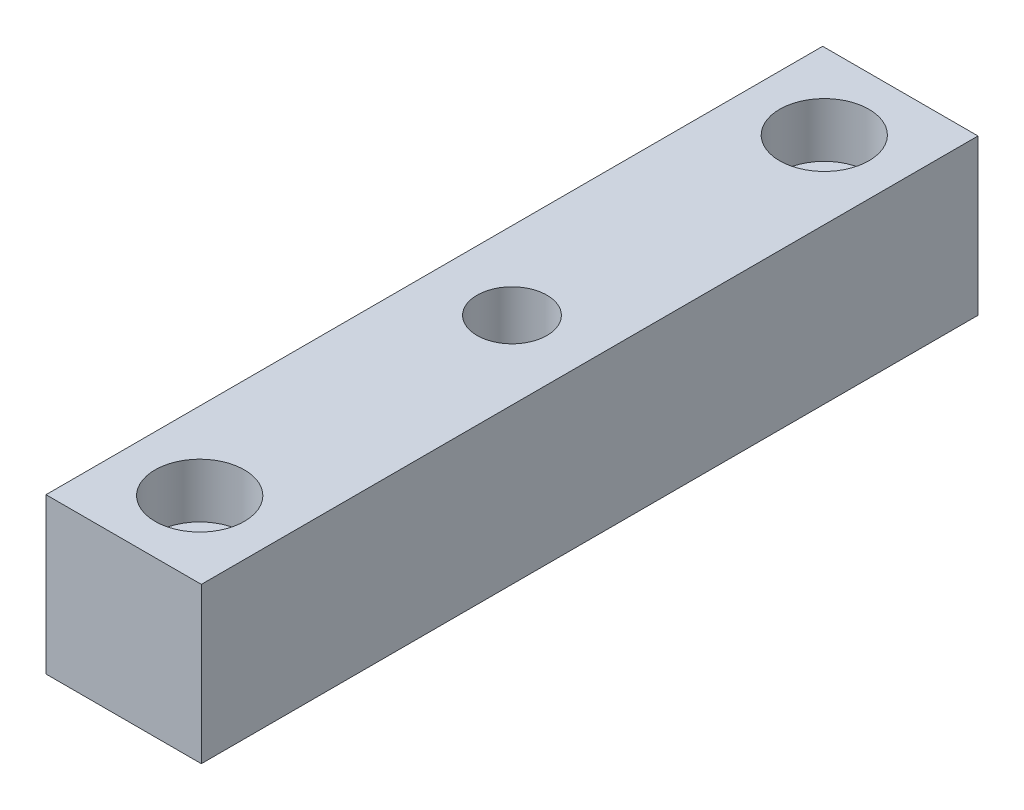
SolidWorks part; units mm, degrees
ref_plane "Plan de face" through (0, 0, 0) normal (0, 0, 1) x (1, 0, 0)
ref_plane "Plan de dessus" through (0, 0, 0) normal (0, 1, 0) x (1, 0, 0)
ref_plane "Plan de droite" through (0, 0, 0) normal (1, 0, 0) x (0, 0, -1)
sketch "Esquisse1" plane through (0, 0, 0) normal (0, 0, 1) x (1, 0, 0)
  line L1 (-20, 20) -> (20, 20)
  line L2 (-20, 20) -> (-20, -20)
  line L3 (-20, -20) -> (20, -20)
  line L4 (20, 20) -> (20, -20)
  dimension "D1" = 40
  dimension "D2" = 20
  dimension "D3" = 40
  dimension "D4" = 20
extrude "Extrusion1" add sketch "Esquisse1" along normal mid plane 200
hole_wizard "Trou taraudé M20x2.01" positions "Esquisse3" profile "Esquisse2" tap size "M20x2.0" standard "ISO"
sketch "Esquisse3" plane through (0, 20, 0) normal (0, 1, 0) x (-1, 0, 0)
  point P0 (0, 0)
sketch "Esquisse2" plane through (0, 20, 0) normal (1, 0, 0) x (0, 0, 1)
  line L0 (0, 0) -> (0, 38.1962)
  line L1 (0, 38.1962) -> (9, 33)
  line L2 (9, 33) -> (9, 0)
  line L5 (9, 0) -> (0, 0)
  line L10 (0, 38.1962) -> (-9, 33) construction
  line L11 (0, -6.35) -> (0, 107.95) construction
  dimension "Diamètre du trou pour taraudage" = 18
  dimension "Profondeur du trou pour taraudage" = 33
  dimension "Angle de pointe" = 120
hole_wizard "Chambrage pour vis à tête cylindrique à 6 pans creux (vis CHC) M141" positions "Esquisse5" profile "Esquisse4" counterbore size "M14" standard "HASCO Metric"
sketch "Esquisse5" plane through (0, 20, 0) normal (0, 1, 0) x (-1, 0, 0)
  point P0 (0, 80.415)
  point P1 (0, -80.415)
  dimension "D1" = 160.83
sketch "Esquisse4" plane through (0, 20, 80.415) normal (1, 0, 0) x (0, 0, 1)
  line L0 (0, 0) -> (0, 40)
  line L1 (0, 40) -> (8, 40)
  line L3 (8, 40) -> (8, 14)
  line L4 (8, 14) -> (11.5, 14)
  line L5 (11.5, 14) -> (11.5, 0)
  line L7 (11.5, 0) -> (0, 0)
  line L11 (0, -6.35) -> (0, 107.95) construction
  dimension "Diamètre du perçage jusqu'au prochain" = 16
  dimension "Profondeur du perçage jusqu'au prochain" = 40
  dimension "Diamètre du chambrage" = 23
  dimension "Profondeur du chambrage" = 14
